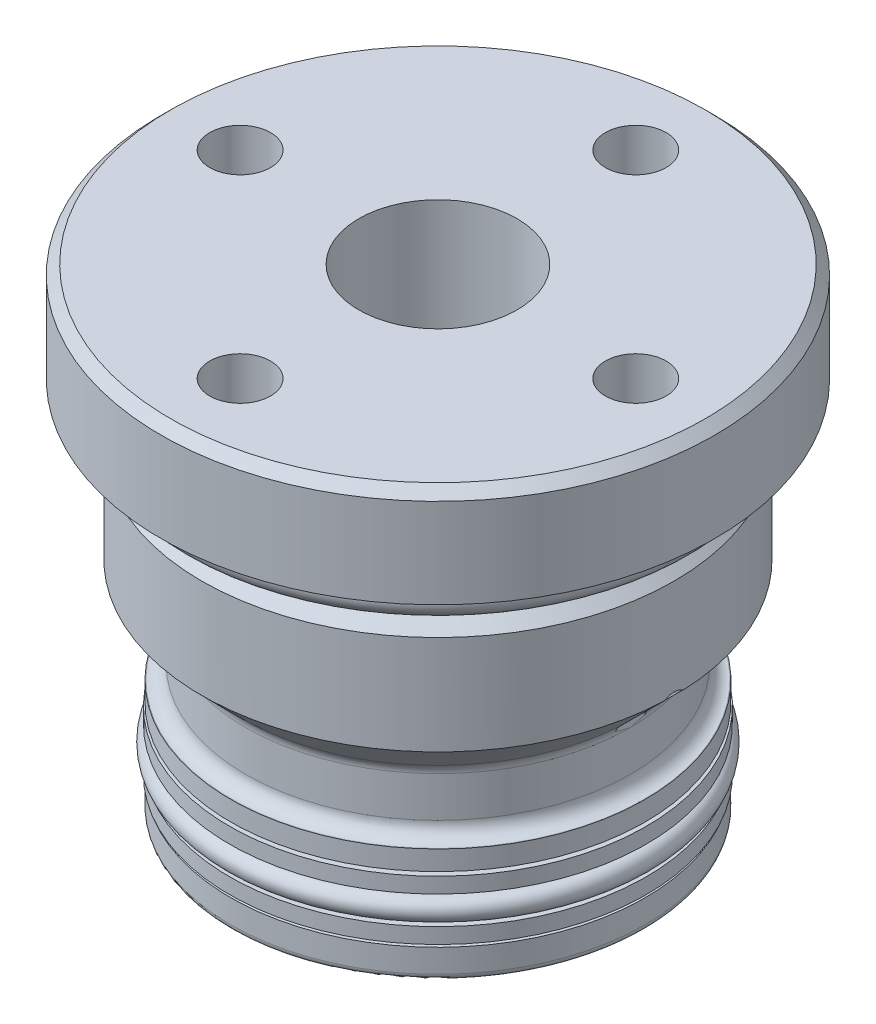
SolidWorks part; units mm, degrees
ref_plane "Front Plane" through (0, 0, 0) normal (0, 0, 1) x (1, 0, 0)
ref_plane "Top Plane" through (0, 0, 0) normal (0, 1, 0) x (1, 0, 0)
ref_plane "Right Plane" through (0, 0, 0) normal (1, 0, 0) x (0, 0, -1)
sketch "Sketch1" plane through (0, 0, 0) normal (0, 0, 1) x (1, 0, 0)
  line L0 (0, 0) -> (0, 29.1031) construction
  line L1 (-12.7, 0) -> (-12.7, 18.2372)
  line L2 (-12.7, 18.2372) -> (-6.35, 18.2372)
  line L3 (-6.35, 18.2372) -> (-6.35, 38.1)
  line L4 (-6.35, 38.1) -> (-22.225, 38.1)
  line L5 (-22.225, 38.1) -> (-22.225, 30.1498)
  line L6 (-22.225, 30.1498) -> (-18.9611, 30.1498)
  line L7 (-18.9611, 30.1498) -> (-18.9611, 17.6149)
  line L8 (-18.9611, 17.6149) -> (-15.4305, 14.0843)
  line L9 (-15.4305, 14.0843) -> (-15.4305, 9.2202)
  line L10 (-15.4305, 9.2202) -> (-16.6243, 9.2202)
  line L11 (-16.6243, 9.2202) -> (-16.6243, 7.6454)
  line L12 (-16.6243, 7.6454) -> (-15.367, 7.6454)
  line L13 (-15.367, 7.6454) -> (-15.367, 2.3876)
  line L14 (-15.367, 2.3876) -> (-16.6243, 2.3876)
  line L15 (-16.6243, 2.3876) -> (-16.6243, 0)
  line L16 (-16.6243, 0) -> (-12.7, 0)
  dimension "D1" = 18.2372
  dimension "D2" = 38.1
  dimension "D3" = 44.45
  dimension "D4" = 12.7
  dimension "D5" = 25.4
  dimension "D6" = 33.2486
  dimension "D7" = 2.3876
  dimension "D8" = 1.5748
  dimension "D9" = 30.734
  dimension "D10" = 5.2578
  dimension "D11" = 30.1498
  dimension "D12" = 37.9222
  dimension "D13" = 30.861
  dimension "D14" = 17.6149
  dimension "D15" = 45
revolve "Revolve1" add sketch "Sketch1" angle 360 about L0
fillet "Fillet1" radius 1.143 2 edges at (0, 14.0843, -15.4305) (0, 9.2202, -15.4305)
fillet "Fillet2" radius 0.381 2 edges at (0, 7.6454, -15.367) (0, 2.3876, -15.367)
fillet "Fillet3" radius 0.508 1 edges at (0, 0, -16.6243)
hole_wizard "Hole1" positions "Sketch3" profile "Sketch2" legacy
sketch "Sketch3" plane through (0, 38.1, 0) normal (0, 1, 0) x (-1, 0, 0)
  circle A0 centre (0, 0) radius 15.875 construction
  point P0 (-15.875, 0)
  dimension "D1" = 15.875
sketch "Sketch2" plane through (15.875, 38.1, 0) normal (1, 0, 0) x (0, 0, 1)
  line L0 (0, 0) -> (0, 6.2149)
  line L1 (0, 6.2149) -> (2.4384, 4.7498)
  line L2 (2.4384, 4.7498) -> (2.4384, 0)
  line L4 (2.4384, 0) -> (0, 0)
  line L6 (0, 6.2149) -> (-2.4384, 4.7498) construction
  line L7 (0, -4.2442) -> (0, 117.3081) construction
  dimension "Diameter" = 4.8768
  dimension "Depth" = 4.7498
  dimension "Drill Angle" = 118
pattern_circular "CirPattern1" count 4 over 360 about axis through (0, 0, 0) along (0, 1, 0) of "Hole1"
chamfer "Chamfer1" distance 0.762 angle 45 1 edges at (0, 38.1, -22.225)
sketch "Sketch4" plane through (0, 0, 0) normal (0, 0, 1) x (1, 0, 0)
  line L0 (0, 0) -> (0, 41.4124) construction
  line L1 (-18.9611, 30.1498) -> (-18.9611, 25.5651)
  line L2 (-18.9611, 30.1498) -> (-18.9611, 17.6149) construction
  line L3 (-18.9611, 25.5651) -> (-17.8308, 26.6954)
  line L4 (-17.8308, 26.6954) -> (-17.8308, 30.1498)
  line L5 (-18.9611, 30.1498) -> (18.9611, 30.1498) construction
  line L6 (-17.8308, 30.1498) -> (-18.9611, 30.1498)
  line L8 (-16.1163, 0) -> (16.1163, 0) construction
  dimension "D1" = 35.6616
  dimension "D3" = 45
  dimension "D4" = 26.6954
revolve "Cut-Revolve1" cut sketch "Sketch4" angle 360 about L0
fillet "Fillet4" radius 0.381 2 edges at (0, 26.6954, -17.8308) (0, 30.1498, -17.8308)
sketch "Sketch5" plane through (0, 0, 0) normal (0, 0, 1) x (1, 0, 0)
  line L0 (-22.225, 30.1498) -> (22.225, 30.1498) construction
  line L1 (0, 0) -> (0, 42.572) construction
  circle A0 centre (-19.1008, 28.8036) radius 1.3081
  dimension "D2" = 2.6162
  dimension "D1" = 1.3462
  dimension "D3" = 38.2016
revolve "Revolve2" add sketch "Sketch5" angle 360 about L1
sketch "Sketch6" plane through (0, 0, 0) normal (0, 0, 1) x (1, 0, 0)
  line L0 (0, 0) -> (0, 49.5791) construction
  line L1 (-15.367, 7.2644) -> (-15.367, 2.7686) construction
  line L2 (-15.367, 6.1468) -> (-16.7132, 6.1468)
  line L3 (-15.367, 6.1468) -> (-15.367, 7.3914)
  line L4 (-15.367, 7.3914) -> (-16.7132, 7.3914)
  line L5 (-16.7132, 6.1468) -> (-16.7132, 7.3914)
  line L6 (-15.367, 5.0165) -> (-17.8863, 5.0165) construction
  line L7 (-16.7132, 3.8862) -> (-16.7132, 2.6416)
  line L8 (-15.367, 2.6416) -> (-16.7132, 2.6416)
  line L9 (-15.367, 3.8862) -> (-15.367, 2.6416)
  line L10 (-15.367, 3.8862) -> (-16.7132, 3.8862)
  line L11 (16.6243, 2.3876) -> (-16.6243, 2.3876) construction
  circle A0 centre (-16.2052, 4.9276) radius 0.889
  dimension "D4" = 1.778
  dimension "D5" = 32.4104
  dimension "D6" = 2.54
  dimension "D1" = 1.2446
  dimension "D2" = 33.4264
  dimension "D3" = 2.2606
revolve "Revolve3" add sketch "Sketch6" angle 360 about L0
sketch "Sketch7" plane through (0, 0, 0) normal (1, 0, 0) x (0, 0, -1)
  line L0 (-16.1163, 0) -> (16.1163, 0) construction
  circle A0 centre (0, 16.6878) radius 1.1811
  dimension "D1" = 2.3622
  dimension "D2" = 16.6878
extrude "Cut-Extrude1" cut sketch "Sketch7" against normal through all and the other way through all
sketch "Sketch8" plane through (0, 0, 0) normal (1, 0, 0) x (0, 0, -1)
  line L0 (-1.1811, 16.6878) -> (-1.1811, 11.9253)
  line L1 (0, 16.6878) -> (0, 11.9253) construction
  line L2 (1.1811, 16.6878) -> (1.1811, 11.9253)
  arc A0 (1.1811, 16.6878) -> (-1.1811, 16.6878) centre (0, 16.6878) ccw
  arc A1 (-1.1811, 11.9253) -> (1.1811, 11.9253) centre (0, 11.9253) ccw
  arc A2 (-0.7318, 17.6149) -> (0.7318, 17.6149) centre (0, 16.6878) ccw construction
  dimension "D1" = 4.7625
extrude "Cut-Extrude3" cut sketch "Sketch8" along normal blind 27.686 from offset 15.4305
mirror "Mirror1" about plane through (0, 0, 0) normal (1, 0, 0) of "Cut-Extrude3"
